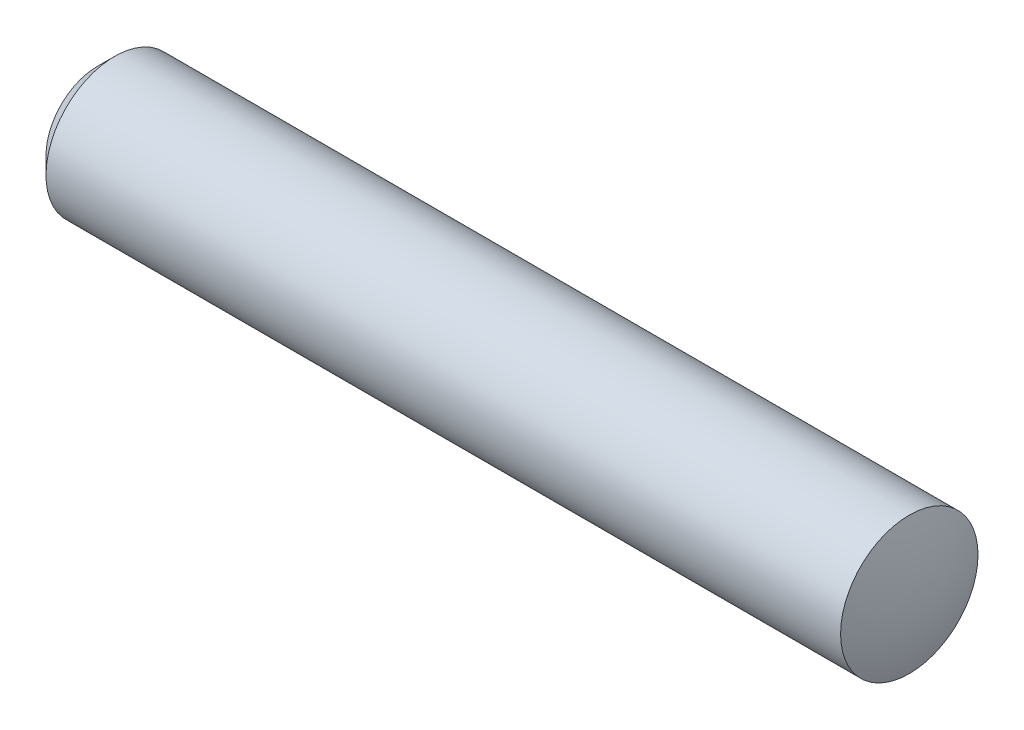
SolidWorks part; units mm, degrees
ref_plane "Front" through (0, 0, 0) normal (0, 0, 1) x (1, 0, 0)
ref_plane "Top" through (0, 0, 0) normal (0, 1, 0) x (1, 0, 0)
ref_plane "Right" through (0, 0, 0) normal (1, 0, 0) x (0, 0, -1)
sketch "Sketch1" plane through (0, 0, 0) normal (0, 0, 1) x (1, 0, 0)
  line L0 (-11.8977, 0) -> (11.8977, 0) construction
  line L1 (-12.1023, 1.5) -> (-11.6023, 2)
  line L2 (-11.6023, 2) -> (-6.1023, 2)
  line L3 (11.8977, 0) -> (11.8977, -7.427) construction
  line L4 (-11.8977, 0) -> (-11.8977, -2.1222) construction
  line L5 (-6.1023, 2) -> (-2.1023, 2)
  line L6 (-2.1023, 2) -> (11.5284, 2)
  line L7 (-7.8682, 16.2978) -> (10.1318, 16.2978) construction
  line L8 (-11.8977, 0) -> (-2.1023, 0)
  line L9 (-4.1023, 2) -> (-4.1023, 0) construction
  line L10 (-12.1023, 1.5) -> (-6.1023, 1.5) construction
  line L11 (-6.1023, 1.5) -> (-6.1023, 2) construction
  line L12 (-2.1023, 0) -> (11.8977, 0)
  line L13 (4.8977, 0) -> (4.8977, -0.4) construction
  line L14 (-9.1023, 1.5) -> (-9.1023, -0.4) construction
  line L15 (-9.1023, -0.4) -> (4.8977, -0.4) construction
  arc A0 (11.5284, 2) -> (11.8977, 0) centre (6.2977, 0) cw
  arc A1 (-12.1023, 1.5) -> (-11.8977, 0) centre (-17.4977, 0) cw
  arc A2 (-11.8977, -0.8204) -> (11.5284, -1.6339) centre (-2.1023, -56.45) cw construction
  dimension "re" = 5.6
  dimension "D1" = 0.5
  dimension "D2" = 45
  dimension "d" = 4
  dimension "bm" = 6
  dimension "b" = 14
  dimension "la" = 4
  dimension "l" = 18
  dimension "F" = 0.4
revolve "Revolve1" add sketch "Sketch1" angle 360 about L8
sketch "Sketch2" plane through (0, 0, 0) normal (0, 0, 1) x (1, 0, 0)
  line L0 (11.5284, 1.5) -> (11.817, 2)
  line L1 (11.817, 2) -> (11.817, 2.5774)
  line L2 (11.817, 2.5774) -> (11.2397, 2.5774)
  line L3 (11.2397, 2.5774) -> (11.2397, 2)
  line L4 (11.2397, 2) -> (11.5284, 1.5)
  line L5 (11.5284, -2) -> (11.5284, 2) construction
  line L6 (0, 0) -> (13.194, 0) construction
  line L7 (-2.1023, 2) -> (11.5284, 2) construction
  dimension "D1" = 3
revolve "Cut-Revolve1" [suppressed] cut sketch "Sketch2" angle 360 about L6
pattern_linear "LPattern1" [suppressed] count 18 along (1, 0, 0)
sketch "Sketch3" plane through (0, 0, 0) normal (0, 0, 1) x (1, 0, 0)
  line L0 (0, 0) -> (-12.6753, 0) construction
  line L1 (-11.6023, 1.5) -> (-11.3136, 2)
  line L2 (-11.3136, 2) -> (-11.3136, 2.5774)
  line L3 (-11.3136, 2.5774) -> (-11.891, 2.5774)
  line L4 (-11.891, 2.5774) -> (-11.891, 2)
  line L5 (-11.891, 2) -> (-11.6023, 1.5)
  line L6 (-11.6023, 2) -> (-6.1023, 2) construction
  line L7 (-11.6023, -2) -> (-11.6023, 2) construction
  dimension "D1" = 3
revolve "Cut-Revolve2" [suppressed] cut sketch "Sketch3" angle 360 about L0
pattern_linear "LPattern2" [suppressed] count 8 spacing 0.8 along (-1, 0, 0)
equation "\"la@Sketch1\" = \"l@Sketch1\" - \"b@Sketch1\""
equation "\"F@Sketch1\" = \"d@Sketch1\" / 10"
equation "\"D1@Cosmetic Thread1\" = \"bm@Sketch1\""
equation "\"D1@Cosmetic Thread2\" = \"b@Sketch1\""
equation "\"D1@Sketch2\" = \"D2@Cosmetic Thread2\""
equation "\"D1@LPattern1\" = \"b@Sketch1\" / \"p@LPattern1\""
equation "\"D1@Sketch3\" = \"D2@Cosmetic Thread1\""
equation "\"D1@LPattern2\" = \"bm@Sketch1\" / \"D3@LPattern2\""
